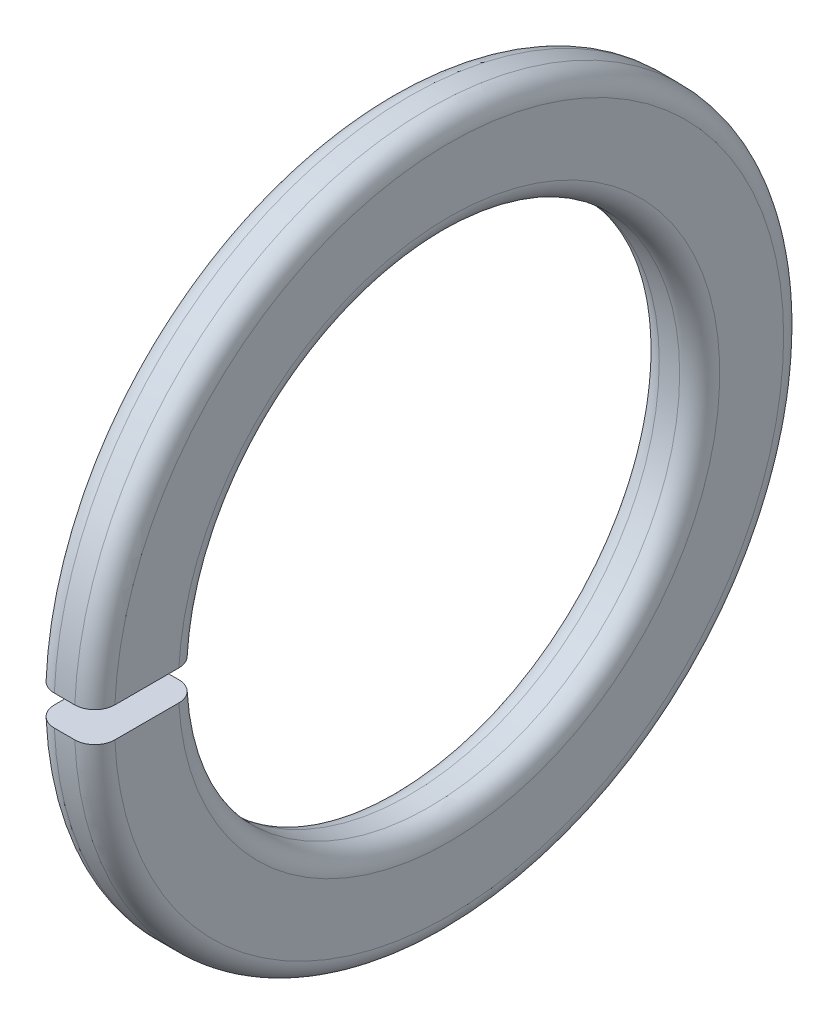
SolidWorks part; units mm, degrees
ref_plane "Plane1" through (0, 0, 0) normal (0, 0, 1) x (1, 0, 0)
ref_plane "Plane2" through (0, 0, 0) normal (0, 1, 0) x (1, 0, 0)
ref_plane "Plane3" through (0, 0, 0) normal (1, 0, 0) x (0, 0, -1)
sketch "Sketch1" plane through (0, 0, 0) normal (0, 0, 1) x (1, 0, 0)
  line L0 (-34.925, 0) -> (9.525, 0) construction
  line L1 (0, 35.8) -> (0, 44.25)
  line L2 (-2.65, 46.9) -> (-5.35, 46.9)
  line L3 (-8, 44.25) -> (-8, 35.8)
  line L4 (-5.35, 33.15) -> (-2.65, 33.15)
  arc A0 (-5.35, 33.15) -> (-8, 35.8) centre (-5.35, 35.8) cw
  arc A1 (0, 35.8) -> (-2.65, 33.15) centre (-2.65, 35.8) cw
  arc A2 (0, 44.25) -> (-2.65, 46.9) centre (-2.65, 44.25) ccw
  arc A3 (-5.35, 46.9) -> (-8, 44.25) centre (-5.35, 44.25) ccw
  point P8 (-8, 33.15)
  point P14 (0, 46.9)
  point P17 (-8, 46.9)
revolve "Base-Revolve" add sketch "Sketch1" angle 360 about L0
sketch "Sketch2" plane through (0, 0, 0) normal (-1, 0, 0) x (0, -1, 0)
  line L0 (-2, 0) -> (2, 0)
  line L1 (0, 0) -> (0, 12.7) construction
  line L2 (2, 0) -> (2, 47.838)
  line L3 (2, 47.838) -> (-2, 47.838)
  line L4 (-2, 47.838) -> (-2, 0)
extrude "Gap" cut sketch "Sketch2" along normal through all
equation "\"D1@Sketch2\" = \"Thickness@Sketch1\" * 0.5"
equation "\"D2@Sketch2\" = \"Outside_dia@Sketch1\" * 0.51"
